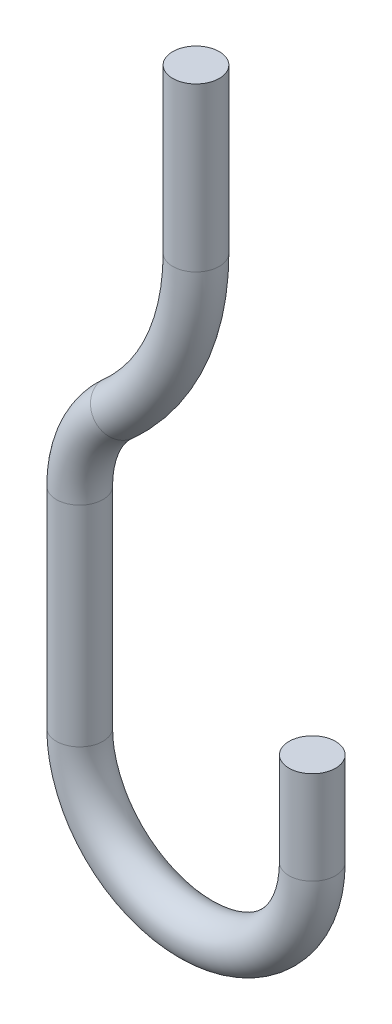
SolidWorks part; units mm, degrees
ref_plane "Front Plane" through (0, 0, 0) normal (0, 0, 1) x (1, 0, 0)
ref_plane "Top Plane" through (0, 0, 0) normal (0, 1, 0) x (1, 0, 0)
ref_plane "Right Plane" through (0, 0, 0) normal (1, 0, 0) x (0, 0, -1)
sketch "Sketch1" plane through (0, 0, 0) normal (0, 0, 1) x (1, 0, 0)
  line L0 (0, 0) -> (0, -35)
  line L1 (-25, -90.9017) -> (-25, -135.9017)
  line L2 (25, -135.9017) -> (25, -115.9017)
  arc A0 (0, -35) -> (-16.6667, -72.2678) centre (-50, -35) cw
  arc A1 (-16.6667, -72.2678) -> (-25, -90.9017) centre (0, -90.9017) ccw
  arc A2 (-25, -135.9017) -> (25, -135.9017) centre (0, -135.9017) ccw
  dimension "D1" = 25
  dimension "D3" = 50
  dimension "D5" = 25
  dimension "D2" = 35
  dimension "D4" = 45
  dimension "D6" = 20
sketch "Sketch2" plane through (0, 0, 0) normal (0, 1, 0) x (1, 0, 0)
  circle A0 centre (0, 0) radius 5
  dimension "D1" = 10
sweep "Sweep1" add profiles "Sketch2" path "Sketch1"
